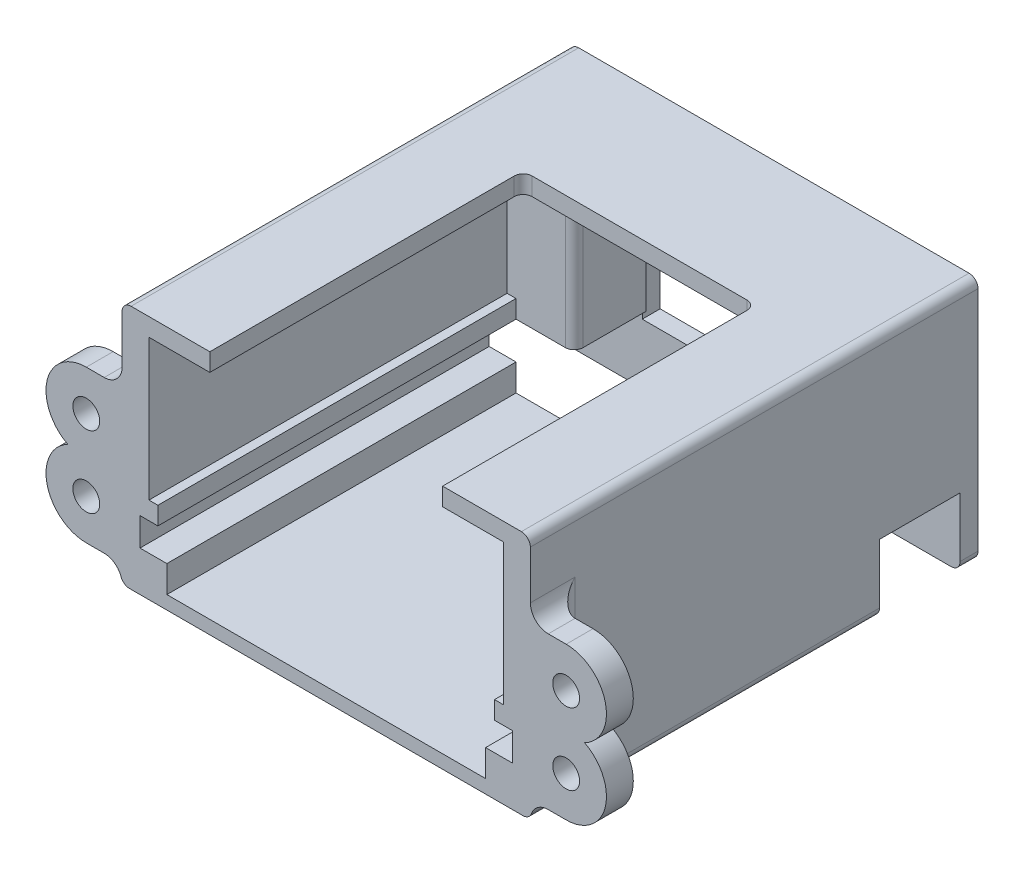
SolidWorks part; units mm, degrees
ref_plane "Front Plane" through (0, 0, 0) normal (0, 0, 1) x (1, 0, 0)
ref_plane "Top Plane" through (0, 0, 0) normal (0, 1, 0) x (1, 0, 0)
ref_plane "Right Plane" through (0, 0, 0) normal (1, 0, 0) x (0, 0, -1)
sketch "Sketch1" plane through (0, 0, 0) normal (0, 0, 1) x (1, 0, 0)
  line L0 (0, 34) -> (0, 0) construction
  line L5 (-17.8, 0) -> (17.8, 0)
  line L6 (-19.8, 23.8908) -> (19.8, 23.8908)
  line L7 (0, 34) -> (-9.7, 34) construction
  line L8 (-18.5, 33.25) -> (-9.7, 33.25) construction
  line L9 (-14.1, 38.25) -> (-14.1, 28.25) construction
  line L10 (18.5, 38.25) -> (18.5, 28.25) construction
  line L11 (18.5, 28.25) -> (9.7, 28.25) construction
  line L12 (9.7, 38.25) -> (9.7, 28.25) construction
  line L13 (18.5, 38.25) -> (9.7, 38.25) construction
  line L14 (17.8, 3) -> (17.8, 0)
  line L15 (20.8, 3) -> (17.8, 3)
  line L16 (20.8, 6.1408) -> (20.8, 3)
  line L17 (18.8, 6.1408) -> (20.8, 6.1408)
  line L18 (18.8, 8.1408) -> (18.8, 6.1408)
  line L19 (19.8, 8.1408) -> (18.8, 8.1408)
  line L20 (19.8, 23.8908) -> (19.8, 8.1408)
  line L21 (-22.8, -1.5) -> (22.8, -1.5)
  line L22 (-22.8, 25.8908) -> (-22.8, -1.5)
  line L23 (-22.8, 6.1408) -> (-22.8, 3) construction
  line L24 (-17.8, -1.5) -> (17.8, -1.5) construction
  line L25 (-22.8, 25.8908) -> (22.8, 25.8908)
  line L26 (-19.8, 25.8908) -> (19.8, 25.8908) construction
  line L27 (22.8, 25.8908) -> (22.8, -1.5)
  line L62 (-19.8, 23.8908) -> (-19.8, 8.1408)
  line L63 (-19.8, 8.1408) -> (-18.8, 8.1408)
  line L64 (-18.8, 8.1408) -> (-18.8, 6.1408)
  line L65 (-18.8, 6.1408) -> (-20.8, 6.1408)
  line L66 (-20.8, 6.1408) -> (-20.8, 3)
  line L67 (-20.8, 3) -> (-17.8, 3)
  line L68 (-17.8, 3) -> (-17.8, 0)
  line L90 (-18.5, 38.25) -> (-9.7, 38.25) construction
  line L91 (-18.5, 38.25) -> (-18.5, 28.25) construction
  line L92 (-18.5, 28.25) -> (-9.7, 28.25) construction
  line L93 (-9.7, 38.25) -> (-9.7, 28.25) construction
  circle A4 centre (-27.75, 21.1408) radius 5.579 construction
  circle A5 centre (27.75, 21.1408) radius 5.579 construction
  circle A20 centre (0, 34) radius 5.5 construction
  point P0 (0, 17)
  point P9 (0, 17)
  point P32 (0, 23.8908)
  dimension "D4" = 14.1
  dimension "D8" = 21.1408
  dimension "D11" = 1.5
  dimension "D12" = 2
  dimension "D21" = 11
  dimension "D10" = 11.1579
  dimension "D1" = 0.75
  dimension "D5" = 23.8908
  dimension "D6" = 27.75
  dimension "D7" = 34
  dimension "D9" = 19.8
  dimension "D13" = 2
  dimension "D24" = 15.75
  dimension "D26" = 2
  dimension "D27" = 3
  dimension "D28" = 1
  dimension "D29" = 3
  dimension "D30" = 1
  dimension "D32" = 10
  dimension "D33" = 8.8
extrude "Boss-Extrude1" add sketch "Sketch1" against normal blind 50
sketch "Sketch2" plane through (0, 25.8908, 0) normal (0, 1, 0) x (1, 0, 0)
  line L0 (0, 0) -> (0, 50) construction
  line L1 (-13, 0) -> (-13, 35)
  line L2 (-13, 35) -> (13, 35)
  line L3 (13, 0) -> (13, 35)
  line L4 (-22.8, 0) -> (22.8, 0)
  line L5 (22.8, 0) -> (22.8, 50)
  line L6 (22.8, 50) -> (-22.8, 50)
  line L7 (-22.8, 50) -> (-22.8, 0)
  line L8 (-22.8, 0) -> (22.8, 0)
  line L9 (22.8, 0) -> (22.8, 50)
  line L10 (22.8, 50) -> (-22.8, 50)
  line L11 (-22.8, 50) -> (-22.8, 0)
  point P11 (0, 35)
  dimension "D2" = 13
  dimension "D3" = 35
  dimension "D1" = 0
extrude "Cut-Extrude1" cut sketch "Sketch2" against normal up to next contours L0 L2 L1 M8 | L0 L8 L3 L2
sketch "Sketch3" plane through (0, 0, -50) normal (0, 0, -1) x (-1, 0, 0)
  line L4 (22.8, 25.8908) -> (-22.8, 25.8908)
  line L5 (-22.8, 25.8908) -> (-22.8, -1.5)
  line L6 (-22.8, -1.5) -> (22.8, -1.5)
  line L7 (22.8, -1.5) -> (22.8, 25.8908)
  line L8 (22.8, 25.8908) -> (-22.8, 25.8908)
  line L9 (-22.8, 25.8908) -> (-22.8, -1.5)
  line L10 (-22.8, -1.5) -> (22.8, -1.5)
  line L11 (22.8, -1.5) -> (22.8, 25.8908)
  dimension "D1" = 0
extrude "Boss-Extrude2" add sketch "Sketch3" against normal blind 2
sketch "Sketch4" plane through (0, 0, -50) normal (0, 0, -1) x (-1, 0, 0)
  line L0 (22.8, 22.5908) -> (-22.8, 22.5908)
  line L1 (0, 25.8908) -> (0, -1.5) construction
  line L2 (-12.7, 22.5908) -> (-12.7, 5.1908)
  line L3 (-12.7, 5.1908) -> (12.7, 5.1908)
  line L4 (22.8, 25.8908) -> (-22.8, 25.8908)
  line L5 (-22.8, 25.8908) -> (-22.8, -1.5)
  line L6 (-22.8, -1.5) -> (22.8, -1.5)
  line L7 (22.8, -1.5) -> (22.8, 25.8908)
  line L8 (22.8, 25.8908) -> (-22.8, 25.8908)
  line L9 (-22.8, 25.8908) -> (-22.8, -1.5)
  line L10 (-22.8, -1.5) -> (22.8, -1.5)
  line L11 (22.8, -1.5) -> (22.8, 25.8908)
  line L12 (12.7, 22.5908) -> (12.7, 5.1908)
  point P12 (0, 5.1908)
  dimension "D3" = 12.7
  dimension "D4" = 17.4
  dimension "D1" = 0
  dimension "D2" = 3.3
extrude "Cut-Extrude2" cut sketch "Sketch4" against normal up to next contours L1 L0 L2 L3 | L0 L1 L3 L12
sketch "Sketch5" plane through (0, -1.5, 0) normal (0, -1, 0) x (1, 0, 0)
  line L0 (0, 0) -> (0, -50) construction
  line L1 (-22.8, -40) -> (-13.3, -40)
  line L2 (-12.3, -41) -> (-12.3, -50)
  line L3 (-19.8, -48) -> (-19.8, 0) construction
  line L4 (22.8, -50) -> (22.8, 0)
  line L5 (22.8, 0) -> (-22.8, 0)
  line L6 (-22.8, 0) -> (-22.8, -50)
  line L7 (-22.8, -50) -> (22.8, -50)
  line L8 (22.8, -50) -> (22.8, 0)
  line L9 (22.8, 0) -> (-22.8, 0)
  line L10 (-22.8, 0) -> (-22.8, -50)
  line L11 (-22.8, -50) -> (22.8, -50)
  line L12 (-19.8, -50) -> (-19.8, 0)
  line L13 (-22.8, -50) -> (22.8, -50) construction
  line L14 (-22.8, -39) -> (-11.67, -39)
  line L15 (-11.67, -39) -> (-11.67, -50)
  line L16 (-22.8, -48) -> (22.8, -48)
  line L17 (19.8, -50) -> (19.8, 0)
  line L18 (11.67, -39) -> (11.67, -50)
  line L19 (22.8, -39) -> (11.67, -39)
  line L20 (12.3, -41) -> (12.3, -50)
  line L21 (22.8, -40) -> (13.3, -40)
  arc A0 (-13.3, -40) -> (-12.3, -41) centre (-13.3, -41) cw
  circle A1 centre (-15.55, -43.25) radius 1.25
  circle A2 centre (15.55, -43.25) radius 1.25
  arc A3 (13.3, -40) -> (12.3, -41) centre (13.3, -41) ccw
  point P20 (-12.3, -40)
  point P37 (12.3, -40)
  dimension "D6" = 1
  dimension "D7" = 2.5
  dimension "D2" = 10
  dimension "D3" = 7.5
  dimension "D4" = 11
  dimension "D5" = 8.13
  dimension "D8" = 3.25
  dimension "D9" = 3.25
  dimension "D1" = 0
  dimension "D10" = 2
extrude "Cut-Extrude3" cut sketch "Sketch5" against normal up to surface (7.6408 mm away) contours A0 L1 L12 L16 L2 A1 | L16 L12 L1 M14 | L14 L10 L1 L12 | L1 A0 L2 L16 L15 L14 L12 | L21 A3 L20 L16 L17 A2 | A3 L21 L17 L19 L18 L16 L20 | L21 L19 L17 M12 | L8 L21 L17 L16 | A1 | A2
sketch "Sketch6" plane through (0, 6.1408, 0) normal (0, -1, 0) x (1, 0, 0)
  line L0 (-22.8, -39) -> (-11.67, -39) construction
  line L1 (-11.67, -39) -> (-11.67, -50) construction
  line L2 (-19.8, -50) -> (-19.8, 0) construction
  line L3 (-12.3, -41) -> (-12.3, -50) construction
  line L4 (22.8, -50) -> (22.8, 0)
  line L5 (22.8, 0) -> (-22.8, 0)
  line L6 (-22.8, 0) -> (-22.8, -50)
  line L7 (-22.8, -50) -> (22.8, -50)
  line L8 (22.8, -50) -> (22.8, 0)
  line L9 (22.8, 0) -> (-22.8, 0)
  line L10 (-22.8, 0) -> (-22.8, -50)
  line L11 (-22.8, -50) -> (22.8, -50)
  line L12 (-22.8, -40) -> (-13.3, -40) construction
  line L13 (19.8, -50) -> (19.8, 0) construction
  line L14 (-22.8, -48) -> (22.8, -48) construction
  line L15 (12.3, -41) -> (12.3, -50) construction
  line L16 (22.8, -40) -> (13.3, -40) construction
  line L17 (11.67, -39) -> (11.67, -50) construction
  line L18 (22.8, -39) -> (11.67, -39) construction
  line L19 (-22.8, -39) -> (-11.67, -39)
  line L20 (-11.67, -39) -> (-11.67, -50)
  line L21 (-19.8, -50) -> (-19.8, 0)
  line L22 (-12.3, -41) -> (-12.3, -50)
  line L23 (-22.8, -40) -> (-13.3, -40)
  line L24 (19.8, -50) -> (19.8, 0)
  line L25 (-22.8, -48) -> (22.8, -48)
  line L26 (12.3, -41) -> (12.3, -50)
  line L27 (22.8, -40) -> (13.3, -40)
  line L28 (11.67, -39) -> (11.67, -50)
  line L29 (22.8, -39) -> (11.67, -39)
  arc A0 (-12.3, -41) -> (-13.3, -40) centre (-13.3, -41) ccw construction
  circle A1 centre (15.55, -43.25) radius 1.25
  circle A2 centre (15.55, -43.25) radius 1.25
  circle A3 centre (-15.55, -43.25) radius 1.25
  circle A4 centre (-15.55, -43.25) radius 1.25
  arc A5 (13.3, -40) -> (12.3, -41) centre (13.3, -41) ccw construction
  arc A6 (-12.3, -41) -> (-13.3, -40) centre (-13.3, -41) ccw
  arc A7 (13.3, -40) -> (12.3, -41) centre (13.3, -41) ccw
  dimension "D1" = 0
  dimension "D2" = 0
  dimension "D3" = 0
extrude "Boss-Extrude3" add sketch "Sketch6" against normal up to surface (17.75 mm away) contours L22 A6 L23 L25 A4 M7 | L23 L21 M12 M7 | L27 A7 L26 L25 L24 A2
sketch "Sketch7" plane through (0, 0, 0) normal (0, 0, 1) x (1, 0, 0)
  line L1 (-26.8, 13) -> (-26.8, 5) construction
  line L2 (-26.8, 17.5) -> (-22.8, 17.5)
  line L3 (-26.8, 0.5) -> (-22.8, 0.5)
  line L4 (-22.8, -1.5) -> (22.8, -1.5)
  line L5 (22.8, -1.5) -> (22.8, 25.8908)
  line L6 (22.8, 25.8908) -> (-22.8, 25.8908)
  line L7 (-22.8, 25.8908) -> (-22.8, -1.5)
  line L8 (-22.8, -1.5) -> (22.8, -1.5)
  line L9 (22.8, -1.5) -> (22.8, 25.8908)
  line L10 (22.8, 25.8908) -> (-22.8, 25.8908)
  line L11 (-22.8, 25.8908) -> (-22.8, -1.5)
  line L12 (0, -15.0649) -> (0, 15.0649) construction
  line L13 (26.8, 0.5) -> (22.8, 0.5)
  line L14 (26.8, 17.5) -> (22.8, 17.5)
  line L24 (-17.8, 0) -> (17.8, 0)
  line L25 (17.8, 0) -> (17.8, 3)
  line L26 (17.8, 3) -> (20.8, 3)
  line L27 (20.8, 3) -> (20.8, 6.1408)
  line L28 (20.8, 6.1408) -> (18.8, 6.1408)
  line L29 (18.8, 6.1408) -> (18.8, 8.1408)
  line L30 (18.8, 8.1408) -> (19.8, 8.1408)
  line L31 (19.8, 8.1408) -> (19.8, 23.8908)
  line L32 (19.8, 23.8908) -> (-19.8, 23.8908)
  line L33 (-19.8, 23.8908) -> (-19.8, 8.1408)
  line L34 (-19.8, 8.1408) -> (-18.8, 8.1408)
  line L35 (-18.8, 8.1408) -> (-18.8, 6.1408)
  line L36 (-18.8, 6.1408) -> (-20.8, 6.1408)
  line L37 (-20.8, 6.1408) -> (-20.8, 3)
  line L38 (-20.8, 3) -> (-17.8, 3)
  line L39 (-17.8, 3) -> (-17.8, 0)
  line L40 (-17.8, 0) -> (17.8, 0)
  line L41 (17.8, 0) -> (17.8, 3)
  line L42 (17.8, 3) -> (20.8, 3)
  line L43 (20.8, 3) -> (20.8, 6.1408)
  line L44 (20.8, 6.1408) -> (18.8, 6.1408)
  line L45 (18.8, 6.1408) -> (18.8, 8.1408)
  line L46 (18.8, 8.1408) -> (19.8, 8.1408)
  line L47 (19.8, 8.1408) -> (19.8, 23.8908)
  line L48 (19.8, 23.8908) -> (-19.8, 23.8908)
  line L49 (-19.8, 23.8908) -> (-19.8, 8.1408)
  line L50 (-19.8, 8.1408) -> (-18.8, 8.1408)
  line L51 (-18.8, 8.1408) -> (-18.8, 6.1408)
  line L52 (-18.8, 6.1408) -> (-20.8, 6.1408)
  line L53 (-20.8, 6.1408) -> (-20.8, 3)
  line L54 (-20.8, 3) -> (-17.8, 3)
  line L55 (-17.8, 3) -> (-17.8, 0)
  circle A0 centre (-26.8, 13) radius 1.5
  circle A1 centre (-26.8, 5) radius 1.5
  arc A2 (-28.8616, 9) -> (-26.8, 0.5) centre (-26.8, 5) ccw
  arc A3 (-26.8, 17.5) -> (-28.8616, 9) centre (-26.8, 13) ccw
  circle A4 centre (-26.8, 5) radius 4.5 construction
  circle A5 centre (-26.8, 13) radius 4.5 construction
  arc A6 (28.8616, 9) -> (26.8, 0.5) centre (26.8, 5) cw
  arc A7 (26.8, 17.5) -> (28.8616, 9) centre (26.8, 13) cw
  circle A8 centre (26.8, 5) radius 1.5
  circle A9 centre (26.8, 13) radius 1.5
  dimension "D1" = 3
  dimension "D2" = 3
  dimension "D3" = 8
  dimension "D6" = 4
  dimension "D8" = 6.5
  dimension "D4" = 0
  dimension "D5" = 0
  dimension "D7" = 3
extrude "Boss-Extrude4" add sketch "Sketch7" against normal blind 3 contours L2 A3 A2 L3 L11 A0 A1 | A7 L14 L9 L13 A6 A8 A9
fillet "Fillet1" radius 2 6 edges at (-22.8, 17.5, -1.5) (-22.8, 0.5, -1.5) (22.8, 0.5, -1.5) (22.8, 17.5, -1.5) (-22.8, 9, -3) (22.8, 9, -3)
fillet "Fillet2" radius 1 10 edges at (22.8, -1.5, -2.5) (-22.8, -1.5, -2.5) (13, 24.8908, -35) (-13, 24.8908, -35) (22.8, 25.8908, -25) (-22.8, 25.8908, -25) (22.8, -1.5, -22) (-22.8, -1.5, -22) (-22.8, -1.5, -49) (22.8, -1.5, -49)
